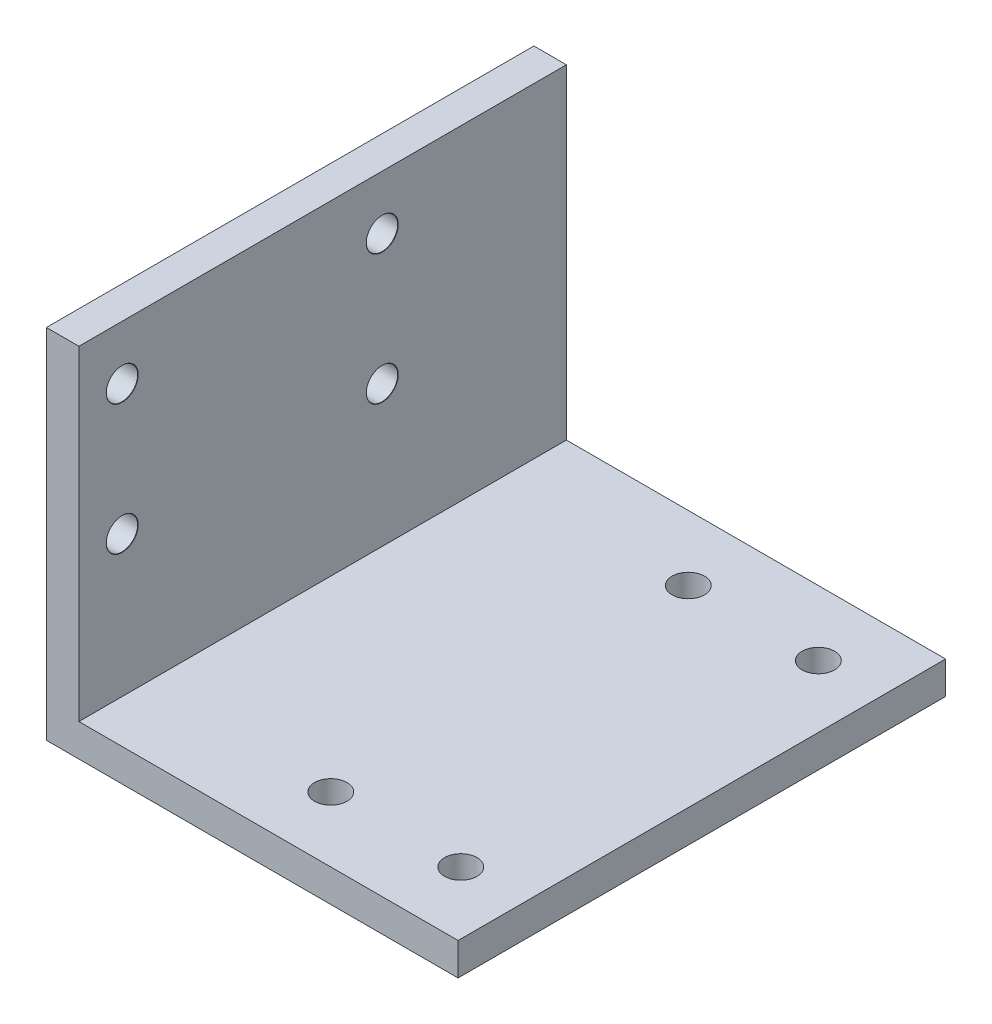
SolidWorks part; units mm, degrees
ref_plane "Front Plane" through (0, 0, 0) normal (0, 0, 1) x (1, 0, 0)
ref_plane "Top Plane" through (0, 0, 0) normal (0, 1, 0) x (1, 0, 0)
ref_plane "Right Plane" through (0, 0, 0) normal (1, 0, 0) x (0, 0, -1)
sketch "Sketch1" plane through (0, 0, 0) normal (0, 1, 0) x (1, 0, 0)
  line L0 (19, 0) -> (-19, 0) construction
  line L1 (-19, -22.5) -> (19, -22.5)
  line L2 (-19, -22.5) -> (-19, 22.5)
  line L3 (-19, 22.5) -> (19, 22.5)
  line L4 (19, -22.5) -> (19, 22.5)
  line L5 (-19, -22.5) -> (19, 22.5) construction
  line L6 (-19, 22.5) -> (19, -22.5) construction
  circle A0 centre (13.25, 16.5) radius 1.5
  circle A1 centre (1.25, 16.5) radius 1.5
  circle A2 centre (13.25, -16.5) radius 1.5
  circle A3 centre (1.25, -16.5) radius 1.5
  point P0 (0, 0)
  dimension "D3" = 5.75
  dimension "D4" = 3
  dimension "D5" = 3
  dimension "D1" = 45
  dimension "D2" = 38
  dimension "D6" = 12
  dimension "D7" = 16.5
extrude "Boss-Extrude1" add sketch "Sketch1" along normal blind 3
sketch "Sketch2" plane through (0, 3, 0) normal (0, 1, 0) x (1, 0, 0)
  line L0 (-19, -22.5) -> (19, -22.5) construction
  line L1 (-16, -22.5) -> (-19, -22.5)
  line L2 (-16, -22.5) -> (-16, 22.5)
  line L3 (-16, 22.5) -> (-19, 22.5)
  line L4 (-19, -22.5) -> (-19, 22.5)
  dimension "D1" = 3
extrude "Boss-Extrude2" add sketch "Sketch2" along normal blind 30
sketch "Sketch3" plane through (-16, 0, 0) normal (1, 0, 0) x (0, 0, -1)
  point P0 (-18.5, 16)
  point P3 (5.5, 16)
  point P6 (5.5, 28)
  point P9 (-18.5, 28)
hole_wizard "M2.5 Clearance Hole1" positions "Sketch3" profile "Sketch4" hole size "M2.5" standard "ANSI Metric"
sketch "Sketch4" plane through (-16, 16, 18.5) normal (0, 1, 0) x (0, 0, -1)
  line L0 (0, 0) -> (0, 6.35)
  line L1 (0, 6.35) -> (1.45, 5.4788)
  line L2 (1.45, 5.4788) -> (1.45, 0.025)
  line L3 (1.45, 0.025) -> (1.475, 0)
  line L5 (1.475, 0) -> (0, 0)
  line L6 (-1.45, 0.025) -> (-1.475, 0) construction
  line L10 (0, 6.35) -> (-1.45, 5.4788) construction
  line L11 (0, -6.35) -> (0, 107.95) construction
  dimension "Hole Dia." = 2.9
  dimension "Hole Depth" = 6.35
  dimension "Near C'Sink Dia." = 2.95
  dimension "Near C'Sink Angle" = 90
  dimension "Drill Angle" = 118
